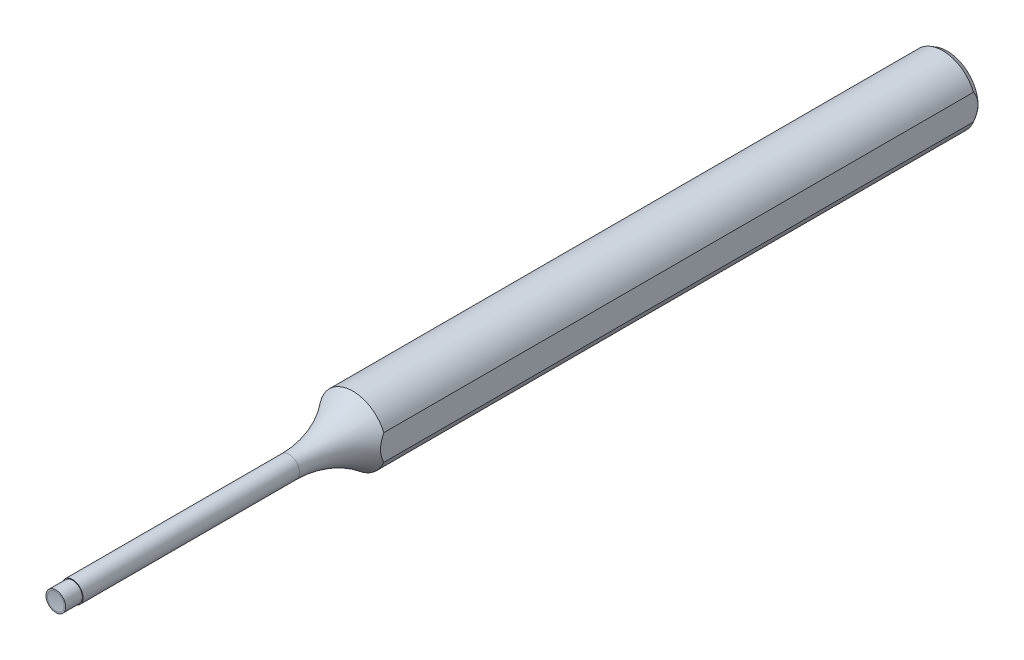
SolidWorks part; units mm, degrees
ref_plane "Front Plane" through (0, 0, 0) normal (0, 0, 1) x (1, 0, 0)
ref_plane "Top Plane" through (0, 0, 0) normal (0, 1, 0) x (1, 0, 0)
ref_plane "Right Plane" through (0, 0, 0) normal (1, 0, 0) x (0, 0, -1)
sketch "Sketch1" plane through (0, 0, 0) normal (0, 0, 1) x (1, 0, 0)
  circle A0 centre (0, 0) radius 4.765
  dimension "D1" = 9.53
extrude "Boss-Extrude1" add sketch "Sketch1" against normal blind 127
sketch "Sketch2" plane through (0, 0, 0) normal (0, 0, 1) x (1, 0, 0)
  circle A0 centre (0, 0) radius 1.5
  dimension "D1" = 3
extrude "Cut-Extrude1" cut sketch "Sketch2" against normal blind 42.3333 flip side to cut
sketch "Sketch3" plane through (0, 0, 0) normal (0, 0, 1) x (1, 0, 0)
  circle A0 centre (0, 0) radius 1.4
  dimension "D1" = 2.8
extrude "Cut-Extrude2" cut sketch "Sketch3" against normal blind 2.3825 flip side to cut
sketch "Sketch4" plane through (0, 0, 0) normal (1, 0, 0) x (0, 0, -1)
  line L0 (0, 0) -> (0, 1.2)
  line L1 (0, 1.4) -> (0, -1.4) construction
  line L2 (0.0759, 0) -> (0.0759, 1.2) construction
  line L3 (0, 0) -> (0.0759, 0)
  line L4 (0, 0) -> (0, -1.2) construction
  arc A0 (0.0759, 0) -> (0, 1.2) centre (-9.4541, 0) ccw
  dimension "D2" = 9.53
  dimension "D1" = 2.4
revolve "Cut-Revolve1" cut sketch "Sketch4" angle 360 about L3
chamfer "Chamfer1" distance 0.6353 angle 30 1 edges at (4.765, 0, -127)
sketch "Sketch5" plane through (0, 0, 0) normal (1, 0, 0) x (0, 0, -1)
  line L0 (42.3333, 0) -> (33.2401, 0)
  line L1 (42.3333, 4.765) -> (42.3333, -4.765) construction
  line L2 (33.2401, 0) -> (33.2401, 1.5)
  line L3 (42.3333, 1.5) -> (2.3825, 1.5) construction
  line L4 (42.3333, 4.765) -> (42.3333, 0)
  line L5 (33.2401, 1.5) -> (42.3333, 1.5) construction
  arc A0 (33.2401, 1.5) -> (42.3333, 4.765) centre (33.2401, 15.795) ccw
  dimension "D1" = 14.295
revolve "Revolve1" add sketch "Sketch5" angle 360 about L0
sketch "Sketch6" plane through (0, 0, 0) normal (1, 0, 0) x (0, 0, -1)
  line L0 (84.6667, 0) -> (98.9617, 0)
  line L1 (84.6667, 0) -> (84.6667, 9.53)
  line L2 (84.6667, 9.53) -> (90.7084, 9.53)
  line L3 (98.9617, 0) -> (98.9617, 4.765)
  line L4 (126.3647, 4.765) -> (42.3333, 4.765) construction
  line L5 (98.9617, 4.765) -> (84.6667, 4.765) construction
  line L6 (127, -4.765) -> (127, 4.765) construction
  arc A0 (98.9617, 4.765) -> (90.7084, 9.53) centre (98.9617, 14.295) cw
  dimension "D2" = 9.53
  dimension "D1" = 42.3333
  dimension "D3" = 14.295
revolve "Revolve2" [suppressed] add sketch "Sketch6" angle 360 about L0
sketch "Sketch7" plane through (0, 0, -127) normal (0, 0, -1) x (-1, 0, 0)
  line L9 (-8.0649, 1.8333) -> (-4.3982, 1.8333)
  line L10 (-8.0649, 1.8333) -> (-8.0649, -1.8333)
  line L11 (-8.0649, -1.8333) -> (-4.3982, -1.8333)
  line L12 (-4.3982, 1.8333) -> (-4.3982, -1.8333)
  circle A5 centre (0, 0) radius 4.765 construction
  circle A6 centre (0, 0) radius 4.3982 construction
  point P8 (-4.3982, 0)
extrude "Cut-Extrude3" cut sketch "Sketch7" against normal through all
